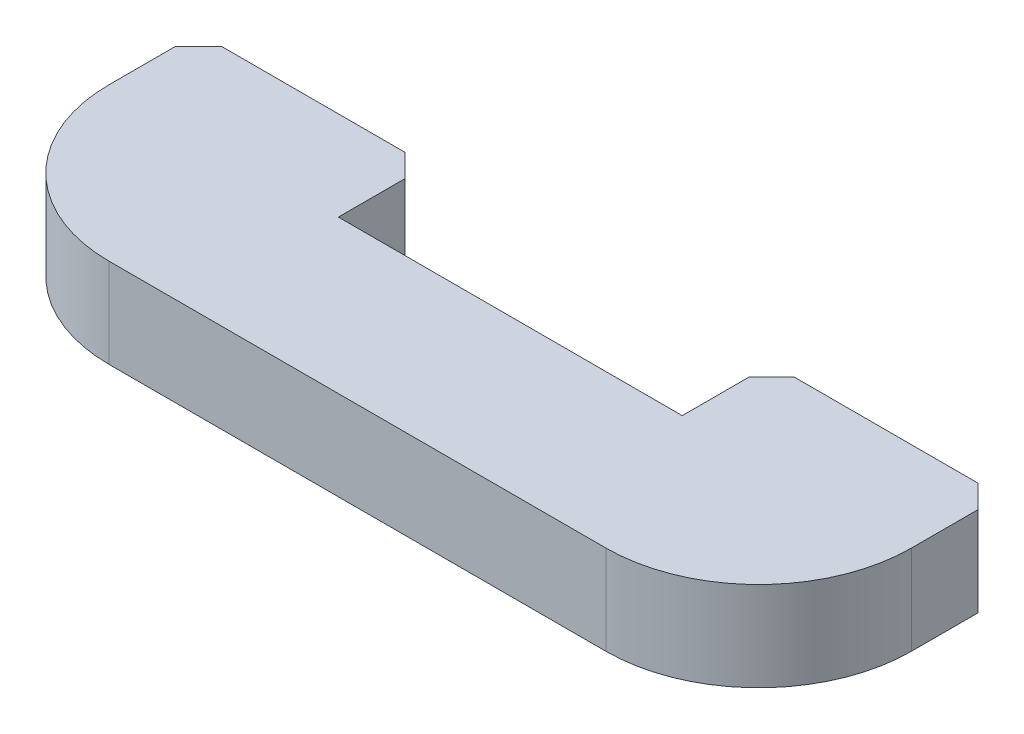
SolidWorks part; units mm, degrees
ref_plane "Front Plane" through (0, 0, 0) normal (0, 0, 1) x (1, 0, 0)
ref_plane "Top Plane" through (0, 0, 0) normal (0, 1, 0) x (1, 0, 0)
ref_plane "Right Plane" through (0, 0, 0) normal (1, 0, 0) x (0, 0, -1)
sketch "Sketch1" plane through (0, 0, 0) normal (0, 1, 0) x (1, 0, 0)
  line L1 (-13.335, 4.0259) -> (13.335, 4.0259)
  line L2 (-13.335, 4.0259) -> (-13.335, -4.0259)
  line L3 (-13.335, -4.0259) -> (13.335, -4.0259)
  line L4 (13.335, 4.0259) -> (13.335, -4.0259)
  line L5 (-13.335, 4.0259) -> (13.335, -4.0259) construction
  line L6 (-13.335, -4.0259) -> (13.335, 4.0259) construction
  point P0 (0, 0)
extrude "Boss-Extrude1" add sketch "Sketch1" along normal blind 2.9718
sketch "Sketch2" plane through (0, 2.9718, 0) normal (0, 1, 0) x (1, 0, 0)
  line L0 (13.335, 4.0259) -> (-13.335, 4.0259) construction
  line L1 (-5.715, 6.9977) -> (5.715, 6.9977)
  line L2 (-5.715, 6.9977) -> (-5.715, 1.0541)
  line L3 (-5.715, 1.0541) -> (5.715, 1.0541)
  line L4 (5.715, 6.9977) -> (5.715, 1.0541)
  line L5 (-5.715, 6.9977) -> (5.715, 1.0541) construction
  line L6 (-5.715, 1.0541) -> (5.715, 6.9977) construction
  point P0 (0, 4.0259)
extrude "Cut-Extrude1" cut sketch "Sketch2" against normal through all
chamfer "Chamfer1" distance 0.762 4 edges at (13.335, 1.4859, -4.0259) (5.715, 1.4859, -4.0259) (-13.335, 1.4859, -4.0259) (-5.715, 1.4859, -4.0259)
fillet "Fillet1" radius 5.08 2 edges at (13.335, 1.4859, 4.0259) (-13.335, 1.4859, 4.0259)
sketch "Sketch3" plane through (0, 2.9718, 0) normal (0, 1, 0) x (1, 0, 0)
  line L24 (-8.255, -4.1275) -> (8.255, -4.1275)
  line L25 (13.4366, 1.0541) -> (13.4366, 3.306)
  line L26 (13.4366, 3.306) -> (12.6151, 4.1275)
  line L27 (12.6151, 4.1275) -> (6.4349, 4.1275)
  line L28 (6.4349, 4.1275) -> (5.6134, 3.306)
  line L29 (5.6134, 3.306) -> (5.6134, 1.1557)
  line L30 (5.6134, 1.1557) -> (-5.6134, 1.1557)
  line L31 (-5.6134, 1.1557) -> (-5.6134, 3.306)
  line L32 (-5.6134, 3.306) -> (-6.4349, 4.1275)
  line L33 (-6.4349, 4.1275) -> (-12.6151, 4.1275)
  line L34 (-12.6151, 4.1275) -> (-13.4366, 3.306)
  line L35 (-13.4366, 3.306) -> (-13.4366, 1.0541)
  line L36 (-8.255, -4.1275) -> (8.255, -4.1275)
  line L37 (13.4366, 1.0541) -> (13.4366, 3.306)
  line L38 (13.4366, 3.306) -> (12.6151, 4.1275)
  line L39 (12.6151, 4.1275) -> (6.4349, 4.1275)
  line L40 (6.4349, 4.1275) -> (5.6134, 3.306)
  line L41 (5.6134, 3.306) -> (5.6134, 1.1557)
  line L42 (5.6134, 1.1557) -> (-5.6134, 1.1557)
  line L43 (-5.6134, 1.1557) -> (-5.6134, 3.306)
  line L44 (-5.6134, 3.306) -> (-6.4349, 4.1275)
  line L45 (-6.4349, 4.1275) -> (-12.6151, 4.1275)
  line L46 (-12.6151, 4.1275) -> (-13.4366, 3.306)
  line L47 (-13.4366, 3.306) -> (-13.4366, 1.0541)
  arc A4 (8.255, -4.1275) -> (13.4366, 1.0541) centre (8.255, 1.0541) ccw
  arc A5 (-13.4366, 1.0541) -> (-8.255, -4.1275) centre (-8.255, 1.0541) ccw
  arc A6 (8.255, -4.1275) -> (13.4366, 1.0541) centre (8.255, 1.0541) ccw
  arc A7 (-13.4366, 1.0541) -> (-8.255, -4.1275) centre (-8.255, 1.0541) ccw
equation "\"D1@Sketch1\"=2*(.375+.300/2)"
equation "\"D2@Sketch1\"=.2 + \"t\""
equation "\"D1@Boss-Extrude1\"=\"t\""
equation "\"t\" = .117'plywood thickness"
equation "\"D1@Sketch2\"=2*(.375-.3/2)"
equation "\"D2@Sketch2\"=\"t\"*2"
equation "\"kerf\"= .004in'Kerf for laser cutter"
equation "\"D1@Sketch3\"=\"kerf\""
